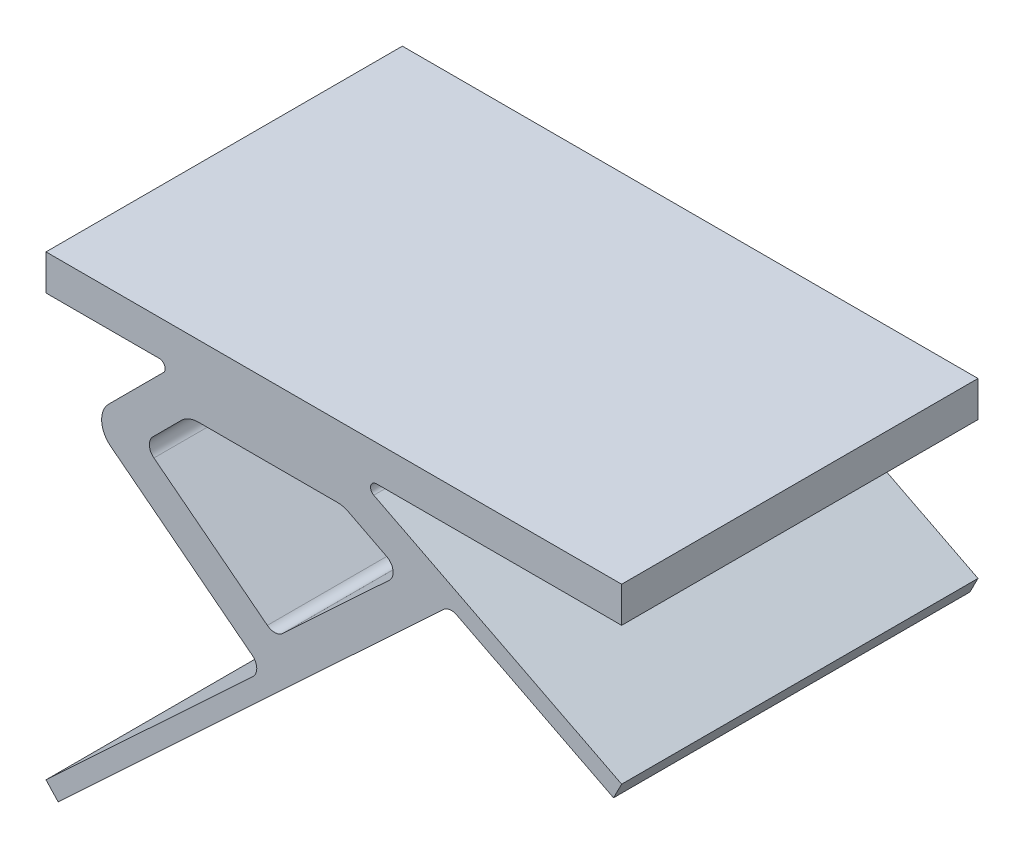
SolidWorks part; units mm, degrees
ref_plane "Front" through (0, 0, 0) normal (0, 0, 1) x (1, 0, 0)
ref_plane "Top" through (0, 0, 0) normal (0, 1, 0) x (1, 0, 0)
ref_plane "Right" through (0, 0, 0) normal (1, 0, 0) x (0, 0, -1)
sketch "Sketch1" plane through (0, 0, 0) normal (0, 0, 1) x (1, 0, 0)
  line L9 (15, 0) -> (23.9101, -4.5399)
  line L10 (23.9101, -4.5399) -> (37.7207, -11.5768)
  line L11 (0, 0) -> (-7.0711, -7.0711)
  line L12 (-7.0711, -7.0711) -> (7.5455, -18.4401)
  line L13 (8.5685, -19.5371) -> (-9.7153, -36.5871)
  line L16 (37.0397, -12.9133) -> (37.7207, -11.5768)
  line L17 (8.5685, -19.5371) -> (23.2218, -5.8727)
  line L18 (1.2426, -3) -> (14.2798, -3)
  line L19 (14.2798, -3) -> (19.2098, -5.512)
  line L20 (1.2426, -3) -> (-2.5468, -6.7895)
  line L21 (-2.5468, -6.7895) -> (8.5685, -15.4352)
  line L22 (8.5685, -15.4352) -> (19.2098, -5.512)
  line L23 (23.2218, -5.8727) -> (37.0397, -12.9133)
  line L24 (7.5455, -18.4401) -> (-10.7383, -35.4901)
  line L25 (-10.7383, -35.4901) -> (-9.7153, -36.5871)
  line L26 (0, 0) -> (-10.7383, 0)
  line L27 (15, 0) -> (37.7207, 0)
  line L28 (-10.7383, 0) -> (-10.7383, 3)
  line L29 (-10.7383, 3) -> (37.7207, 3)
  line L30 (37.7207, 3) -> (37.7207, 0)
  line L31 (15, 0) -> (0, 0) construction
  dimension "D1" = 15
  dimension "D2" = 10
  dimension "D3" = 25.5
  dimension "D4" = 10
  dimension "D5" = 20
  dimension "D6" = 25
  dimension "D7" = 3
  dimension "D8" = 135
  dimension "D9" = 1.5
  dimension "D10" = 1.5
  dimension "D11" = 110
  dimension "D12" = 3
  dimension "D13" = 99.124
  dimension "D14" = 3
  dimension "D15" = 3
  dimension "D16" = 3
  dimension "D17" = 3
extrude "Boss-Extrude1" add sketch "Sketch1" along normal blind 30
fillet "Fillet1" radius 2 1 edges at (-7.0711, -7.0711, 15)
fillet "Fillet4" radius 2 1 edges at (1.2426, -3, 15)
fillet "Fillet5" radius 2 1 edges at (14.2798, -3, 15)
fillet "Fillet6" radius 1 1 edges at (-2.5468, -6.7895, 15)
fillet "Fillet7" radius 1 1 edges at (19.2098, -5.512, 15)
fillet "Fillet8" radius 1 1 edges at (8.5685, -15.4352, 15)
fillet "Fillet9" radius 1 1 edges at (23.2218, -5.8727, 15)
fillet "Fillet10" radius 1 1 edges at (7.5455, -18.4401, 15)
fillet "Fillet11" radius 0.5 1 edges at (15, 0, 15)
fillet "Fillet12" radius 0.5 1 edges at (0, 0, 15)
